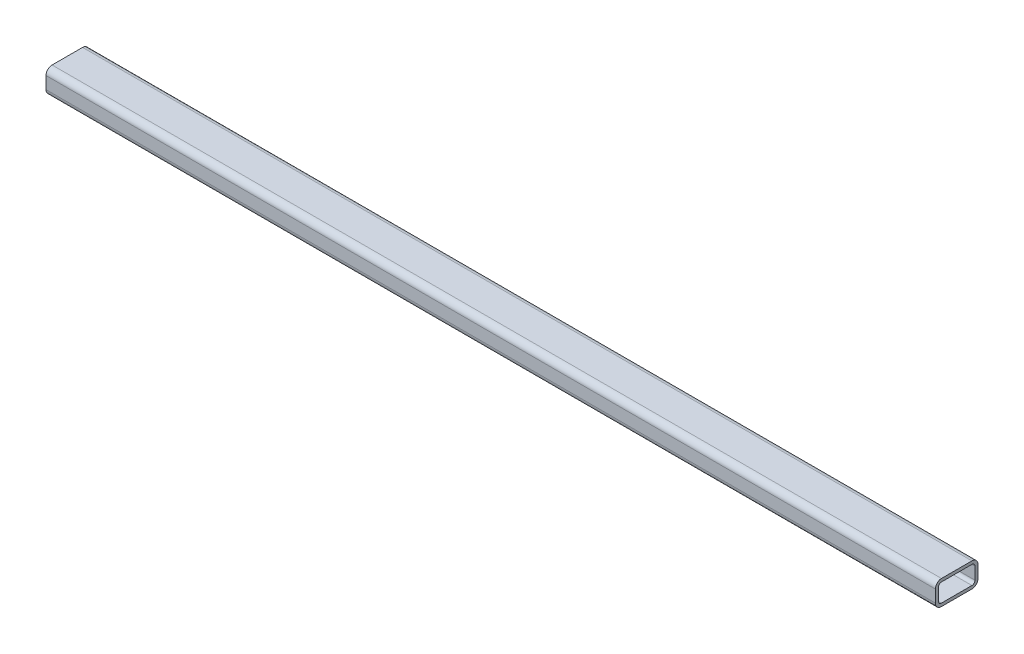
SolidWorks part; units mm, degrees
ref_plane "Plan1" through (0, 0, 0) normal (0, 0, 1) x (1, 0, 0)
ref_plane "Plan2" through (0, 0, 0) normal (0, 1, 0) x (1, 0, 0)
ref_plane "Plan3" through (0, 0, 0) normal (1, 0, 0) x (0, 0, -1)
sketch "Esquisse1" plane through (0, 0, 0) normal (1, 0, 0) x (0, 0, -1)
  line L0 (-17.5, 0) -> (17.5, 0) construction
  line L1 (-12.5, 10) -> (12.5, 10)
  line L2 (-17.5, 5) -> (-17.5, -5)
  line L3 (-12.5, -10) -> (12.5, -10)
  line L4 (17.5, 5) -> (17.5, -5)
  line L5 (0, -10) -> (0, 10) construction
  line L6 (-12.5, 7.5) -> (12.5, 7.5)
  line L7 (15, 5) -> (15, -5)
  line L8 (-12.5, -7.5) -> (12.5, -7.5)
  line L9 (-15, 5) -> (-15, -5)
  arc A0 (17.5, 5) -> (12.5, 10) centre (12.5, 5) ccw
  arc A1 (-17.5, 5) -> (-12.5, 10) centre (-12.5, 5) cw
  arc A2 (-12.5, -10) -> (-17.5, -5) centre (-12.5, -5) cw
  arc A3 (17.5, -5) -> (12.5, -10) centre (12.5, -5) cw
  arc A4 (-15, 5) -> (-12.5, 7.5) centre (-12.5, 5) cw
  arc A5 (15, 5) -> (12.5, 7.5) centre (12.5, 5) ccw
  arc A6 (15, -5) -> (12.5, -7.5) centre (12.5, -5) cw
  arc A7 (-12.5, -7.5) -> (-15, -5) centre (-12.5, -5) cw
  dimension "e" = 2.5
  dimension "C" = 20
  dimension "B" = 35
extrude "Base-Extrusion" add sketch "Esquisse1" along normal blind 730
